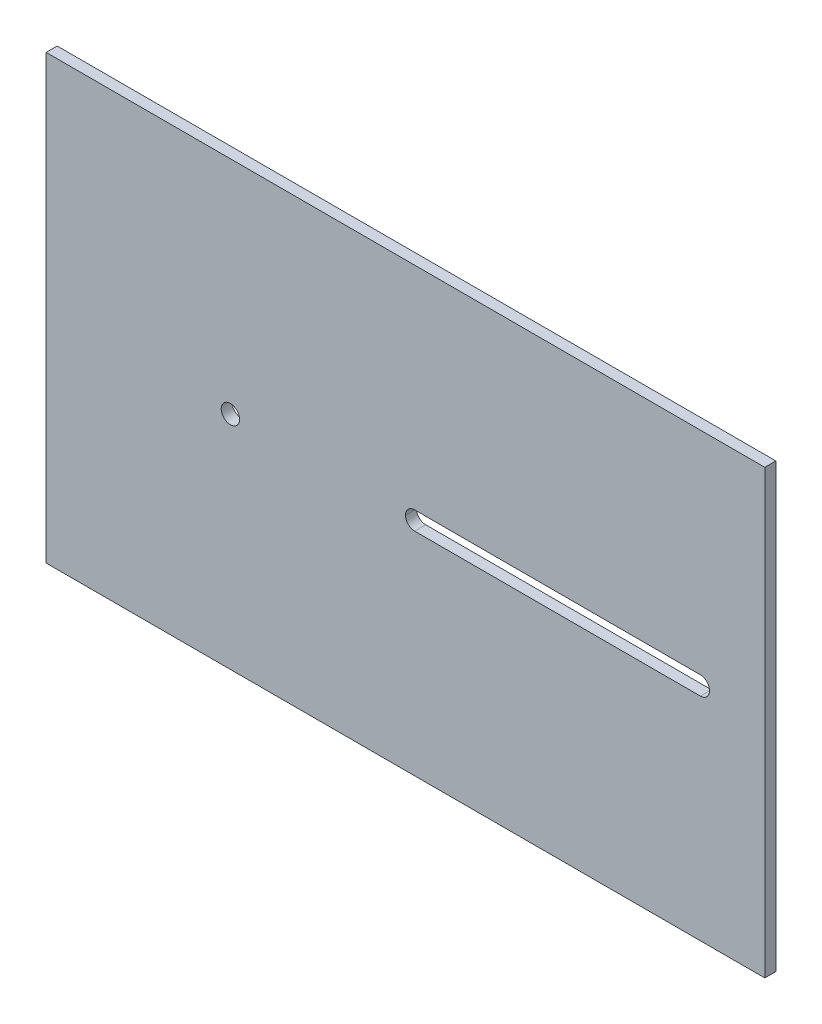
SolidWorks part; units mm, degrees
ref_plane "Plan de face" through (0, 0, 0) normal (0, 0, 1) x (1, 0, 0)
ref_plane "Plan de dessus" through (0, 0, 0) normal (0, 1, 0) x (1, 0, 0)
ref_plane "Plan de droite" through (0, 0, 0) normal (1, 0, 0) x (0, 0, -1)
sketch "Esquisse1" plane through (0, 0, 0) normal (0, 0, 1) x (1, 0, 0)
  line L1 (-75.7745, 50.7636) -> (119.2255, 50.7636)
  line L2 (-75.7745, 50.7636) -> (-75.7745, -69.2364)
  line L3 (-75.7745, -69.2364) -> (119.2255, -69.2364)
  line L4 (119.2255, 50.7636) -> (119.2255, -69.2364)
  dimension "D1" = 195
  dimension "D2" = 120
extrude "Extrusion1" add sketch "Esquisse1" along normal blind 3
sketch "Esquisse2" plane through (0, 0, 3) normal (0, 0, 1) x (1, 0, 0)
  line L2 (119.2255, 50.7636) -> (-75.7745, 50.7636) construction
  line L3 (-75.7745, 50.7636) -> (-75.7745, -69.2364) construction
  line L5 (119.2255, -69.2364) -> (119.2255, 50.7636) construction
  line L8 (24.2155, -6.7364) -> (101.7355, -6.7364)
  line L9 (21.7255, -9.2264) -> (21.7255, -9.2464)
  line L10 (24.2155, -11.7364) -> (101.7355, -11.7364)
  line L11 (104.2255, -9.2264) -> (104.2255, -9.2464)
  arc A0 (24.2155, -6.7364) -> (21.7255, -9.2264) centre (24.2155, -9.2264) ccw
  arc A1 (24.2155, -11.7364) -> (21.7255, -9.2464) centre (24.2155, -9.2464) cw
  circle A2 centre (-25.7745, -9.2364) radius 2.5
  arc A3 (101.7355, -6.7364) -> (104.2255, -9.2264) centre (101.7355, -9.2264) cw
  arc A4 (101.7355, -11.7364) -> (104.2255, -9.2464) centre (101.7355, -9.2464) ccw
  point P10 (119.2255, -9.2364)
  point P15 (21.7255, -6.7364)
  point P20 (104.2255, -6.7364)
  point P23 (104.2255, -11.7364)
  dimension "D1" = 60
  dimension "D2" = 50
  dimension "D3" = 5
  dimension "D4" = 5
  dimension "D5" = 82.5
  dimension "D6" = 57.5
  dimension "D8" = 2.49
  dimension "D7" = 15
extrude "Enlèv. mat.-Extru.1" cut sketch "Esquisse2" against normal through all
